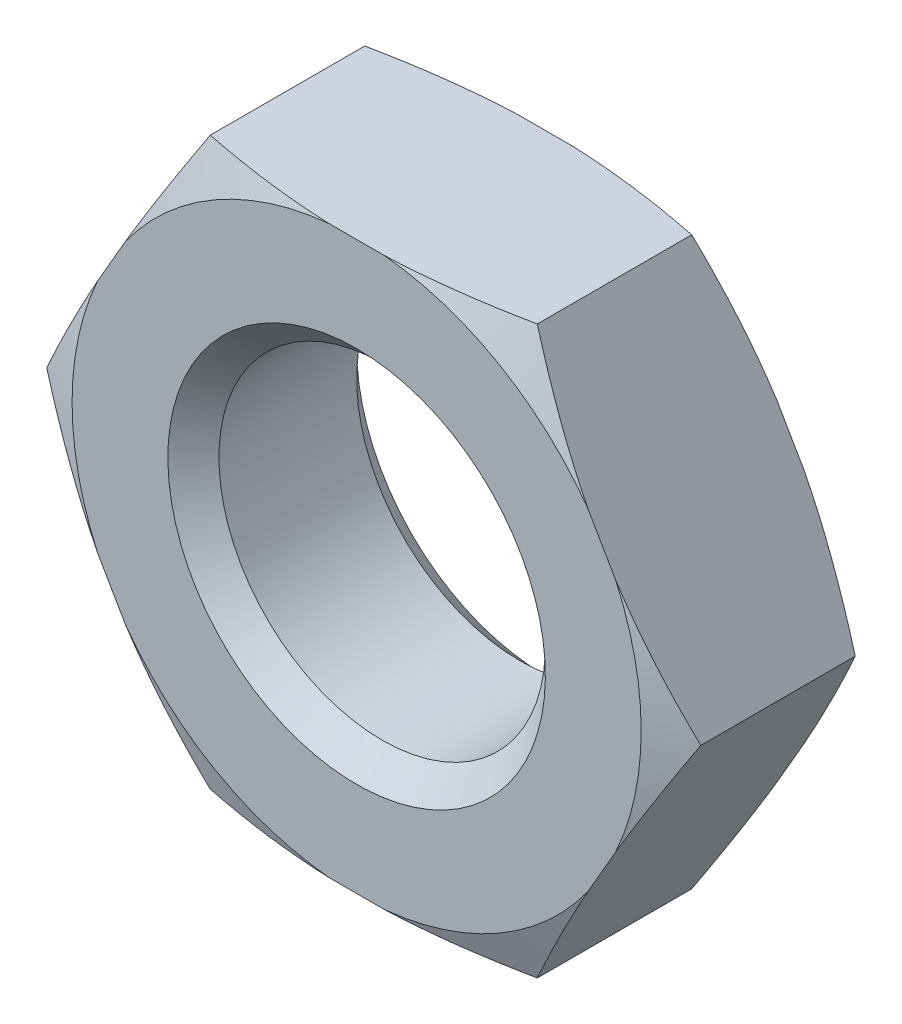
SolidWorks part; units mm, degrees
other "<Ecrou bas Hm M16 pas gauche>-<Ecrou >"
ref_plane "Plan de face" through (0, 0, 0) normal (0, 0, 1) x (1, 0, 0)
ref_plane "Plan de dessus" through (0, 0, 0) normal (0, 1, 0) x (1, 0, 0)
ref_plane "Plan de droite" through (0, 0, 0) normal (1, 0, 0) x (0, 0, -1)
mirrored part "Ecrou bas Hm M16 pas gauche_Symétrique"
